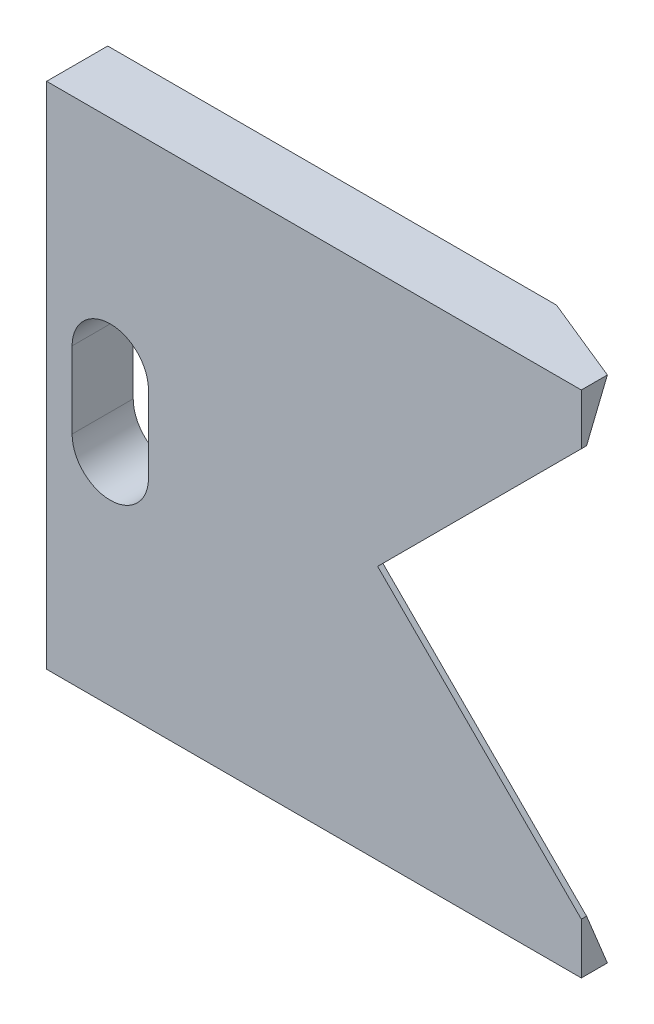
SolidWorks part; units mm, degrees
ref_plane "FACE" through (0, 0, 0) normal (0, 0, 1) x (1, 0, 0)
ref_plane "DESSUS" through (0, 0, 0) normal (0, 1, 0) x (1, 0, 0)
ref_plane "GAUCHE" through (0, 0, 0) normal (1, 0, 0) x (0, 0, -1)
sketch "Esquisse1" plane through (0, 0, 0) normal (0, 0, 1) x (1, 0, 0)
  line L0 (0, 0) -> (41, 0) construction
  line L1 (0, -10) -> (0, 10)
  line L2 (0, 10) -> (23, 10)
  line L3 (0, -10) -> (23, -10)
  line L4 (23, 10) -> (13, 0)
  line L5 (23, -10) -> (13, 0)
  line L8 (4, 1.5) -> (4, -1.5)
  line L9 (1, 1.5) -> (1, -1.5)
  arc A0 (4, 1.5) -> (1, 1.5) centre (2.5, 1.5) ccw
  arc A1 (1, -1.5) -> (4, -1.5) centre (2.5, -1.5) ccw
  dimension "D5" = 3
  dimension "D6" = 1.5
  dimension "D2" = 10
  dimension "D3" = 13
  dimension "D4" = 45
  dimension "D7" = 2.5
  dimension "D8" = 2.5
  dimension "D9" = 3
extrude "Base-Extrusion" add sketch "Esquisse1" along normal blind 2.4
chamfer "Chanfrein7" distance 3.8 angle 30
sketch "Esquisse2" plane through (0, 0, 2.4) normal (0, 0, 1) x (1, 0, 0)
  line L0 (21, -10) -> (21, -8)
  line L1 (0, 10) -> (0, -10) construction
  line L2 (0, -10) -> (23, -10) construction
  line L3 (23, -10) -> (13, 0) construction
  line L4 (13, 0) -> (23, 10) construction
  line L5 (23, 10) -> (0, 10) construction
  line L6 (21, -10) -> (23, -10)
  line L7 (23, -10) -> (21, -8)
  line L8 (21, 8) -> (23, 10)
  line L9 (23, 10) -> (21, 10)
  line L10 (21, 8) -> (21, 10)
  dimension "D1" = 21
extrude "Enlèv. mat.-Extru.1" cut sketch "Esquisse2" against normal through all
